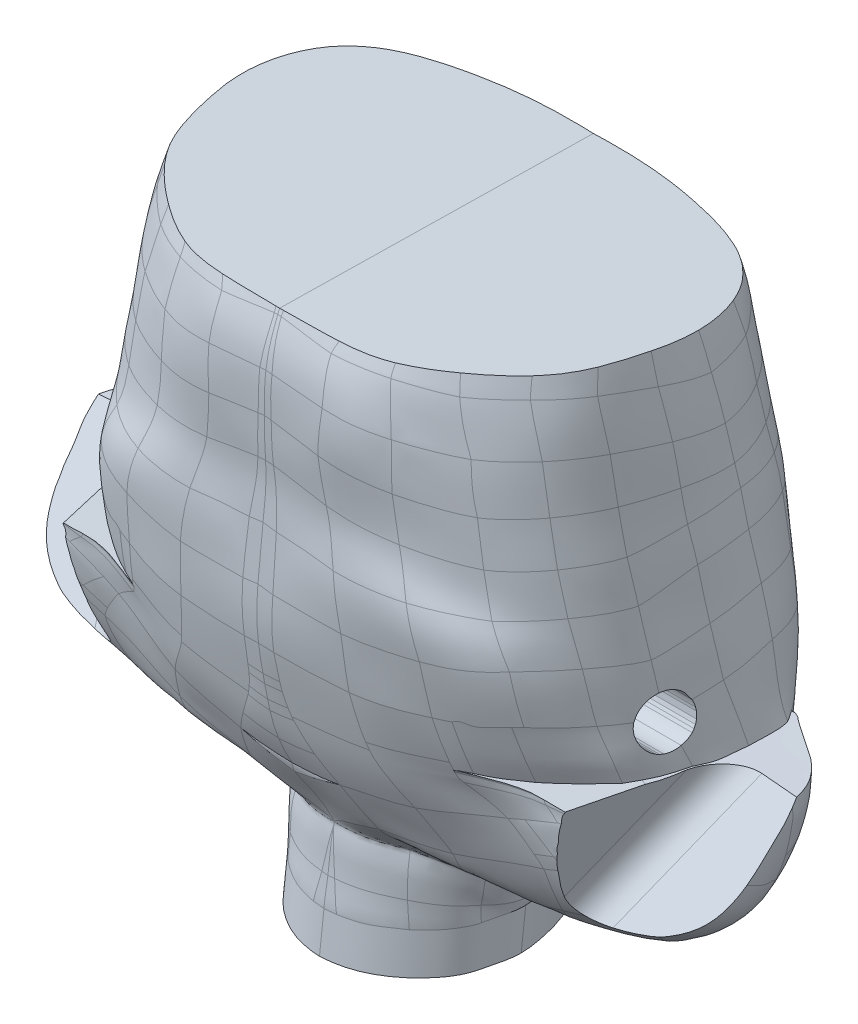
SolidWorks part; units mm, degrees
ref_plane "Front Plane" through (0, 0, 0) normal (0, 0, 1) x (1, 0, 0)
ref_plane "Top Plane" through (0, 0, 0) normal (0, 1, 0) x (1, 0, 0)
ref_plane "Right Plane" through (0, 0, 0) normal (1, 0, 0) x (0, 0, -1)
imported_body "torso_aug_2_2005 (A).stp<1>"
surface "Surface-Knit1"
